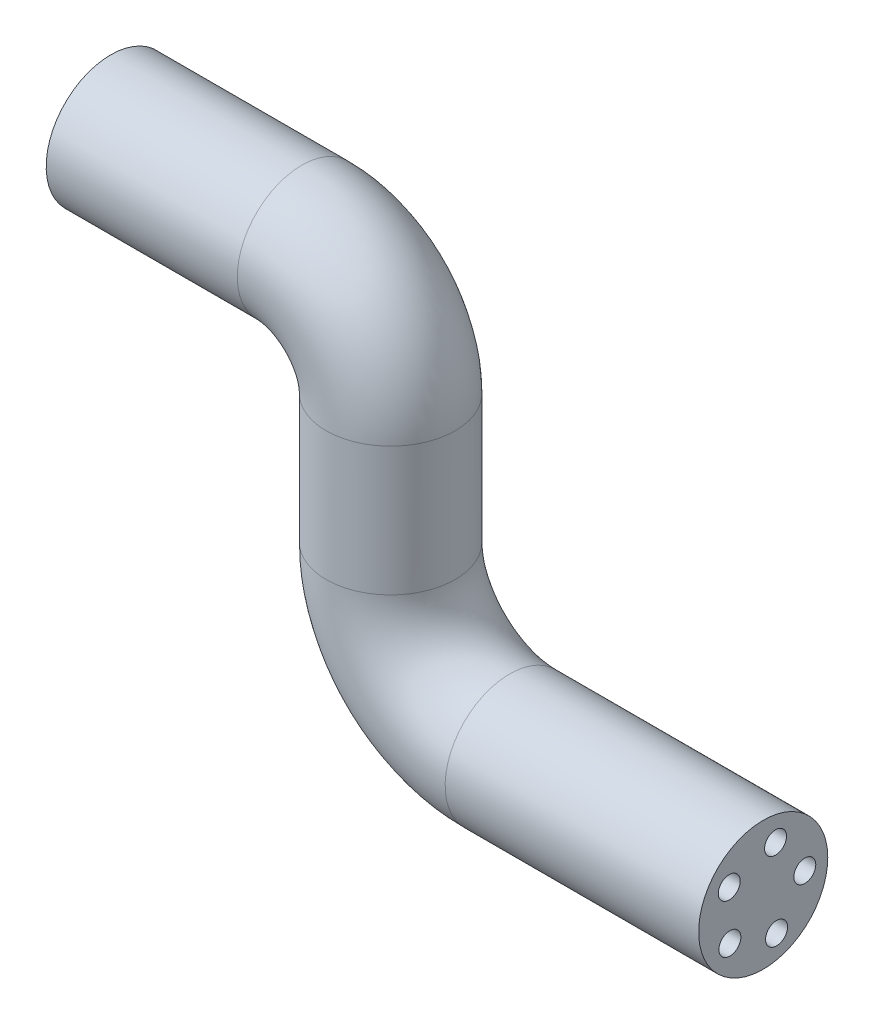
SolidWorks part; units mm, degrees
ref_plane "Front Plane" through (0, 0, 0) normal (0, 0, 1) x (1, 0, 0)
ref_plane "Top Plane" through (0, 0, 0) normal (0, 1, 0) x (1, 0, 0)
ref_plane "Right Plane" through (0, 0, 0) normal (1, 0, 0) x (0, 0, -1)
sketch "Sketch1" plane through (0, 0, 0) normal (0, 0, 1) x (1, 0, 0)
  line L0 (0, 0) -> (80.2165, 0)
  line L1 (117.2753, -37.0588) -> (117.2753, -91.1353)
  line L2 (167.459, -141.319) -> (273.8642, -141.319)
  arc A0 (80.2165, 0) -> (117.2753, -37.0588) centre (80.2165, -37.0588) cw
  arc A1 (117.2753, -91.1353) -> (167.459, -141.319) centre (167.459, -91.1353) ccw
ref_plane "Plane1" through (273.8642, -141.319, 0) normal (1, 0, 0) x (0, 0, -1)
sketch "Sketch2" plane through (273.8642, -141.319, 0) normal (1, 0, 0) x (0, 0, -1)
  circle A0 centre (0, 0.2195) radius 27.0969
  circle A1 centre (17.4561, 0.2195) radius 4.6082
  circle A2 centre (5.603, -16.5339) radius 4.6082
  circle A3 centre (-13.9932, -10.438) radius 4.6082
  circle A4 centre (-14.2513, 10.0828) radius 4.6082
  circle A5 centre (5.1854, 16.6696) radius 4.6082
sweep "Sweep1" add profiles "Sketch2" path "Sketch1"
